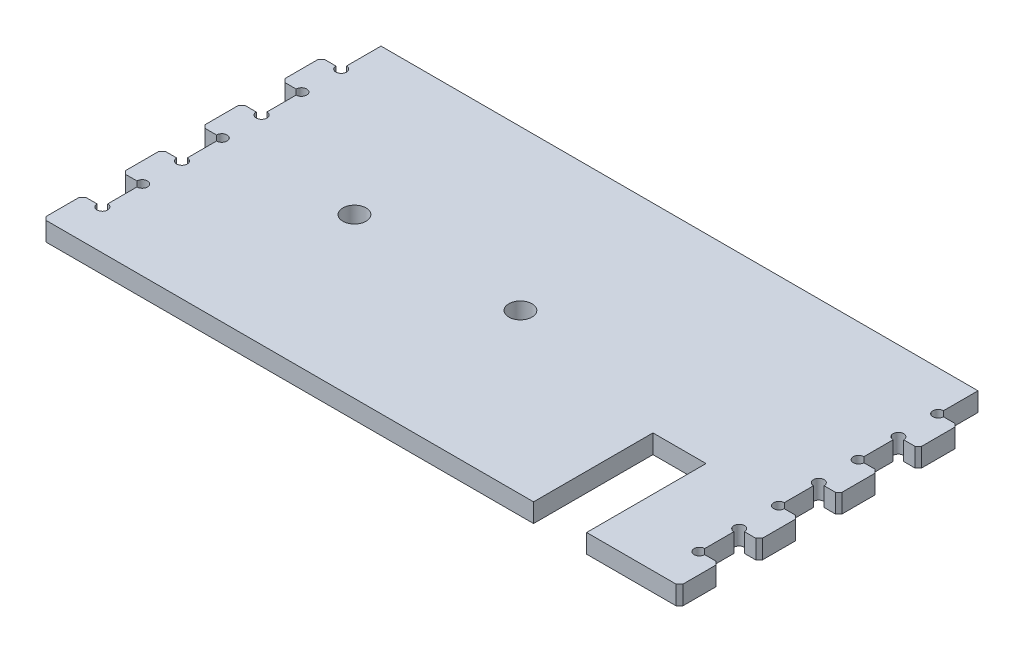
SolidWorks part; units mm, degrees
ref_plane "Front Plane" through (0, 0, 0) normal (0, 0, 1) x (1, 0, 0)
ref_plane "Top Plane" through (0, 0, 0) normal (0, 1, 0) x (1, 0, 0)
ref_plane "Right Plane" through (0, 0, 0) normal (1, 0, 0) x (0, 0, -1)
sketch "panel" plane through (0, 0, 0) normal (0, 1, 0) x (1, 0, 0)
  line L0 (127, 304.8) -> (127, 0) construction
  line L1 (0, 0) -> (571.5, 0)
  line L2 (0, 0) -> (0, 304.8)
  line L3 (0, 304.8) -> (571.5, 304.8)
  line L4 (571.5, 0) -> (571.5, 304.8)
  line L5 (285.877, 304.8) -> (285.877, 0) construction
  circle A0 centre (127, 152.4) radius 11.1125
  circle A1 centre (285.877, 152.4) radius 11.1125
  dimension "D1" = 127
  dimension "D4" = 22.225
  dimension "D5" = 22.225
  dimension "height" = 304.8
  dimension "D2" = 158.877
  dimension "D3" = 571.5
extrude "panelx" add sketch "panel" along normal blind 18.034
sketch "tabs" plane through (0, 18.034, 0) normal (0, 1, 0) x (1, 0, 0)
  line L0 (285.75, 304.8) -> (285.75, 0) construction
  line L1 (0, 0) -> (-19.05, 0)
  line L2 (0, 0) -> (0, 38.1)
  line L3 (0, 38.1) -> (-19.05, 38.1)
  line L4 (-19.05, 0) -> (-19.05, 38.1)
  line L5 (571.5, 304.8) -> (0, 304.8) construction
  line L6 (0, 0) -> (571.5, 0) construction
  line L7 (590.55, 0) -> (590.55, 38.1)
  line L8 (571.5, 38.1) -> (590.55, 38.1)
  line L9 (571.5, 0) -> (571.5, 38.1)
  line L10 (571.5, 0) -> (590.55, 0)
  line L11 (0, 76.2) -> (-19.05, 76.2)
  line L12 (0, 76.2) -> (0, 114.3)
  line L13 (0, 114.3) -> (-19.05, 114.3)
  line L14 (-19.05, 76.2) -> (-19.05, 114.3)
  line L15 (590.55, 76.2) -> (590.55, 114.3)
  line L16 (571.5, 114.3) -> (590.55, 114.3)
  line L17 (571.5, 76.2) -> (571.5, 114.3)
  line L18 (571.5, 76.2) -> (590.55, 76.2)
  line L19 (0, 152.4) -> (-19.05, 152.4)
  line L20 (0, 152.4) -> (0, 190.5)
  line L21 (0, 190.5) -> (-19.05, 190.5)
  line L22 (-19.05, 152.4) -> (-19.05, 190.5)
  line L23 (590.55, 152.4) -> (590.55, 190.5)
  line L24 (571.5, 190.5) -> (590.55, 190.5)
  line L25 (571.5, 152.4) -> (571.5, 190.5)
  line L26 (571.5, 152.4) -> (590.55, 152.4)
  line L27 (0, 228.6) -> (-19.05, 228.6)
  line L28 (0, 228.6) -> (0, 266.7)
  line L29 (0, 266.7) -> (-19.05, 266.7)
  line L30 (-19.05, 228.6) -> (-19.05, 266.7)
  line L31 (590.55, 228.6) -> (590.55, 266.7)
  line L32 (571.5, 266.7) -> (590.55, 266.7)
  line L33 (571.5, 228.6) -> (571.5, 266.7)
  line L34 (571.5, 228.6) -> (590.55, 228.6)
  dimension "D1" = 19.05
  dimension "D2" = 38.1
  dimension "D3" = 4
extrude "tabsx" add sketch "tabs" against normal up to surface (18.034 mm away)
chamfer "pressfit" distance 3.175 angle 45 16 edges at (590.55, 9.017, 0) (590.55, 9.017, -38.1) (590.55, 9.017, -76.2) (590.55, 9.017, -114.3) (590.55, 9.017, -152.4) (590.55, 9.017, -190.5) (590.55, 9.017, -228.6) (590.55, 9.017, -266.7) (-19.05, 9.017, 0) (-19.05, 9.017, -38.1) (-19.05, 9.017, -76.2) (-19.05, 9.017, -114.3) (-19.05, 9.017, -152.4) (-19.05, 9.017, -190.5) (-19.05, 9.017, -228.6) (-19.05, 9.017, -266.7)
sketch "shopbotconsideration" plane through (0, 18.034, 0) normal (0, 1, 0) x (1, 0, 0)
  circle A0 centre (0, 266.7) radius 5.08
  circle A1 centre (571.5, 266.7) radius 5.08
  circle A2 centre (571.5, 228.6) radius 5.08
  circle A3 centre (571.5, 190.5) radius 5.08
  circle A4 centre (571.5, 152.4) radius 5.08
  circle A5 centre (571.5, 114.3) radius 5.08
  circle A6 centre (571.5, 76.2) radius 5.08
  circle A7 centre (571.5, 38.1) radius 5.08
  circle A8 centre (0, 228.6) radius 5.08
  circle A9 centre (0, 190.5) radius 5.08
  circle A10 centre (0, 152.4) radius 5.08
  circle A11 centre (0, 114.3) radius 5.08
  circle A12 centre (0, 76.2) radius 5.08
  circle A13 centre (0, 38.1) radius 5.08
  dimension "D1" = 7
extrude "SBconsideration" cut sketch "shopbotconsideration" against normal up to surface (18.034 mm away)
sketch "drain cutaway" plane through (0, 18.034, 0) normal (0, 1, 0) x (1, 0, 0)
  line L0 (285.75, 0) -> (285.75, 304.8) construction
  line L1 (-15.875, 0) -> (587.375, 0) construction
  line L2 (571.5, 304.8) -> (0, 304.8) construction
  line L4 (450.85, 0) -> (501.65, 0)
  line L5 (450.85, 0) -> (450.85, 114.3)
  line L6 (450.85, 114.3) -> (501.65, 114.3)
  line L7 (501.65, 0) -> (501.65, 114.3)
  dimension "D1" = 50.8
  dimension "D2" = 114.3
  dimension "D3" = 165.1
extrude "Cut-Extrude1" cut sketch "drain cutaway" against normal up to next
